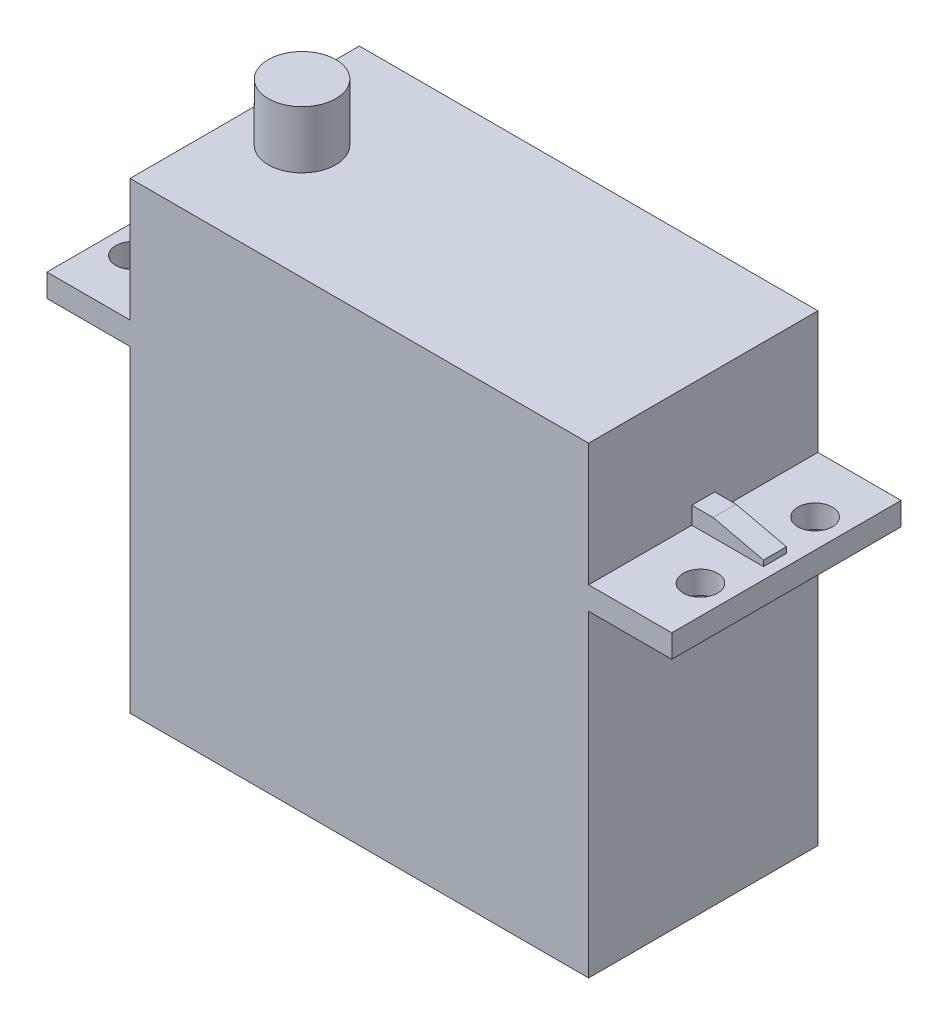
SolidWorks part; units mm, degrees
ref_plane "Alzado" through (0, 0, 0) normal (0, 0, 1) x (1, 0, 0)
ref_plane "Planta" through (0, 0, 0) normal (0, 1, 0) x (1, 0, 0)
ref_plane "Vista lateral" through (0, 0, 0) normal (1, 0, 0) x (0, 0, -1)
sketch "Croquis1" plane through (0, 0, 0) normal (0, 1, 0) x (1, 0, 0)
  line L1 (-20, -10) -> (20, -10)
  line L2 (-20, -10) -> (-20, 10)
  line L3 (-20, 10) -> (20, 10)
  line L4 (20, -10) -> (20, 10)
  line L5 (-20, -10) -> (20, 10) construction
  line L6 (-20, 10) -> (20, -10) construction
  point P0 (0, 0)
  dimension "D1" = 40
  dimension "D2" = 20
extrude "Saliente-Extruir1" add sketch "Croquis1" along normal blind 40.4
sketch "Croquis2" plane through (0, 0, 10) normal (0, 0, 1) x (1, 0, 0)
  line L0 (-20, 27.7) -> (-27.25, 27.7)
  line L1 (-20, 40.4) -> (-20, 0) construction
  line L2 (-27.25, 27.7) -> (-27.25, 29.7)
  line L3 (-27.25, 29.7) -> (-20, 29.7)
  line L4 (-20, 29.7) -> (-20, 27.7)
  line L5 (11, 0) -> (-11, 0) construction
  line L6 (0, -11) -> (0, 11) construction
  line L7 (27.25, 29.7) -> (20, 29.7)
  line L8 (27.25, 27.7) -> (27.25, 29.7)
  line L9 (20, 27.7) -> (27.25, 27.7)
  line L10 (20, 29.7) -> (20, 27.7)
  dimension "D1" = 27.7
  dimension "D2" = 27.25
  dimension "D3" = 2
extrude "Saliente-Extruir2" add sketch "Croquis2" against normal up to surface (20 mm away)
sketch "Croquis3" plane through (0, 0, 0) normal (0, 0, 1) x (1, 0, 0)
  line L0 (-26.25, 29.7) -> (-26.25, 30.2)
  line L1 (-20, 29.7) -> (-27.25, 29.7) construction
  line L2 (-26.25, 30.2) -> (-21.8602, 31.2135)
  line L3 (-21.8602, 31.2135) -> (-20, 31.2135)
  line L4 (-20, 40.4) -> (-20, 29.7) construction
  line L5 (-20, 31.2135) -> (-20, 29.7)
  line L6 (-20, 29.7) -> (-26.25, 29.7)
  line L7 (-27.25, 29.7) -> (-27.25, 27.7) construction
  line L8 (-26.6926, 30.2) -> (-24.9593, 30.2) construction
  line L9 (0, -11) -> (0, 11) construction
  line L10 (20, 31.2135) -> (20, 29.7)
  line L11 (21.8602, 31.2135) -> (20, 31.2135)
  line L12 (26.25, 30.2) -> (21.8602, 31.2135)
  line L13 (26.25, 29.7) -> (26.25, 30.2)
  line L14 (20, 29.7) -> (26.25, 29.7)
  dimension "D1" = 1
  dimension "D2" = 1.5135
  dimension "D3" = 0.5
  dimension "D4" = 13
extrude "Saliente-Extruir3" add sketch "Croquis3" along normal blind 1 and the other way blind 1
sketch "Croquis4" plane through (0, 29.7, 0) normal (0, 1, 0) x (1, 0, 0)
  line L1 (-22.22, 0) -> (22.22, 0) construction
  line L2 (0, -11) -> (0, 11) construction
  circle A0 centre (-24.75, 5) radius 1.5
  circle A1 centre (-24.75, -5) radius 1.5
  circle A2 centre (24.75, -5) radius 1.5
  circle A3 centre (24.75, 5) radius 1.5
  dimension "D3" = 3
  dimension "D6" = 3
  dimension "D1" = 10
  dimension "D2" = 5
  dimension "D4" = 49.5
  dimension "D5" = 49.5
extrude "Cortar-Extruir7" cut sketch "Croquis4" against normal blind 2
sketch "Croquis5" plane through (0, 40.4, 0) normal (0, 1, 0) x (1, 0, 0)
  line L2 (-22.22, 0) -> (22.22, 0) construction
  line L4 (-20, 10) -> (-20, -10) construction
  circle A0 centre (-15, 0) radius 2.95
  dimension "D3" = 5.9
  dimension "D2" = 5
extrude "Saliente-Extruir4" add sketch "Croquis5" along normal blind 5
